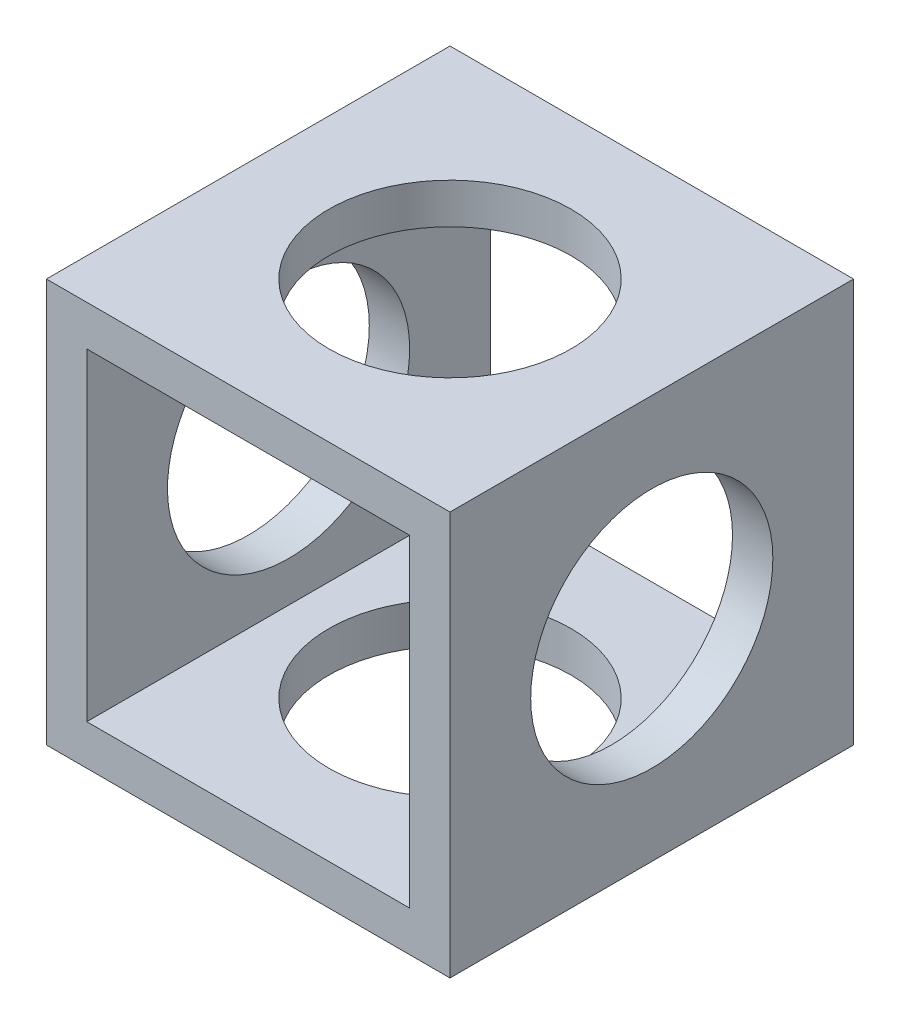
SolidWorks part; units mm, degrees
ref_plane "Alzado" through (0, 0, 0) normal (0, 0, 1) x (1, 0, 0)
ref_plane "Planta" through (0, 0, 0) normal (0, 1, 0) x (1, 0, 0)
ref_plane "Vista lateral" through (0, 0, 0) normal (1, 0, 0) x (0, 0, -1)
sketch "Croquis1" plane through (0, 0, 0) normal (0, 0, 1) x (1, 0, 0)
  line L0 (-20, 20) -> (20, 20)
  line L1 (-25, 25) -> (25, 25)
  line L2 (-25, 25) -> (-25, -25)
  line L3 (-25, -25) -> (25, -25)
  line L4 (25, 25) -> (25, -25)
  line L5 (-25, 25) -> (25, -25) construction
  line L6 (-25, -25) -> (25, 25) construction
  line L7 (20, 20) -> (20, -20)
  line L8 (-20, -20) -> (20, -20)
  line L9 (-20, 20) -> (-20, -20)
  point P0 (0, 0)
  dimension "D1" = 50
  dimension "D2" = 50
  dimension "D3" = 5
extrude "Saliente-Extruir1" add sketch "Croquis1" along normal mid plane 50
hole_wizard "Taladro1" positions "Croquis2" profile "Croquis3" legacy
sketch "Croquis2" plane through (25, 0, 0) normal (1, 0, 0) x (0, 0, -1)
  point P0 (0, 0)
sketch "Croquis3" plane through (25, 0, 0) normal (0, 1, 0) x (0, 0, -1)
  line L0 (0, 0) -> (0, 50)
  line L1 (0, 50) -> (15, 50)
  line L2 (15, 50) -> (15, 0)
  line L3 (15, 0) -> (0, 0)
  line L4 (0, 110) -> (0, -10) construction
  dimension "Diámetro" = 30
  dimension "Profundidad" = 50
hole_wizard "Taladro3" positions "Croquis6" profile "Croquis7" legacy
sketch "Croquis6" plane through (0, -20, 0) normal (0, 1, 0) x (1, 0, 0)
  point P0 (0, 0)
sketch "Croquis7" plane through (0, -20, 0) normal (1, 0, 0) x (0, 0, 1)
  line L0 (0, 0) -> (0, 5)
  line L1 (0, 5) -> (15, 5)
  line L2 (15, 5) -> (15, 0)
  line L3 (15, 0) -> (0, 0)
  line L4 (0, 110) -> (0, -10) construction
  dimension "Diámetro" = 30
  dimension "Profundidad" = 5
hole_wizard "Taladro4" positions "Croquis8" profile "Croquis9" legacy
sketch "Croquis8" plane through (0, 25, 0) normal (0, 1, 0) x (1, 0, 0)
  point P0 (0, 0)
sketch "Croquis9" plane through (0, 25, 0) normal (1, 0, 0) x (0, 0, 1)
  line L0 (0, 0) -> (0, 50)
  line L1 (0, 50) -> (15, 50)
  line L2 (15, 50) -> (15, 0)
  line L3 (15, 0) -> (0, 0)
  line L4 (0, 110) -> (0, -10) construction
  dimension "Diámetro" = 30
  dimension "Profundidad" = 50
